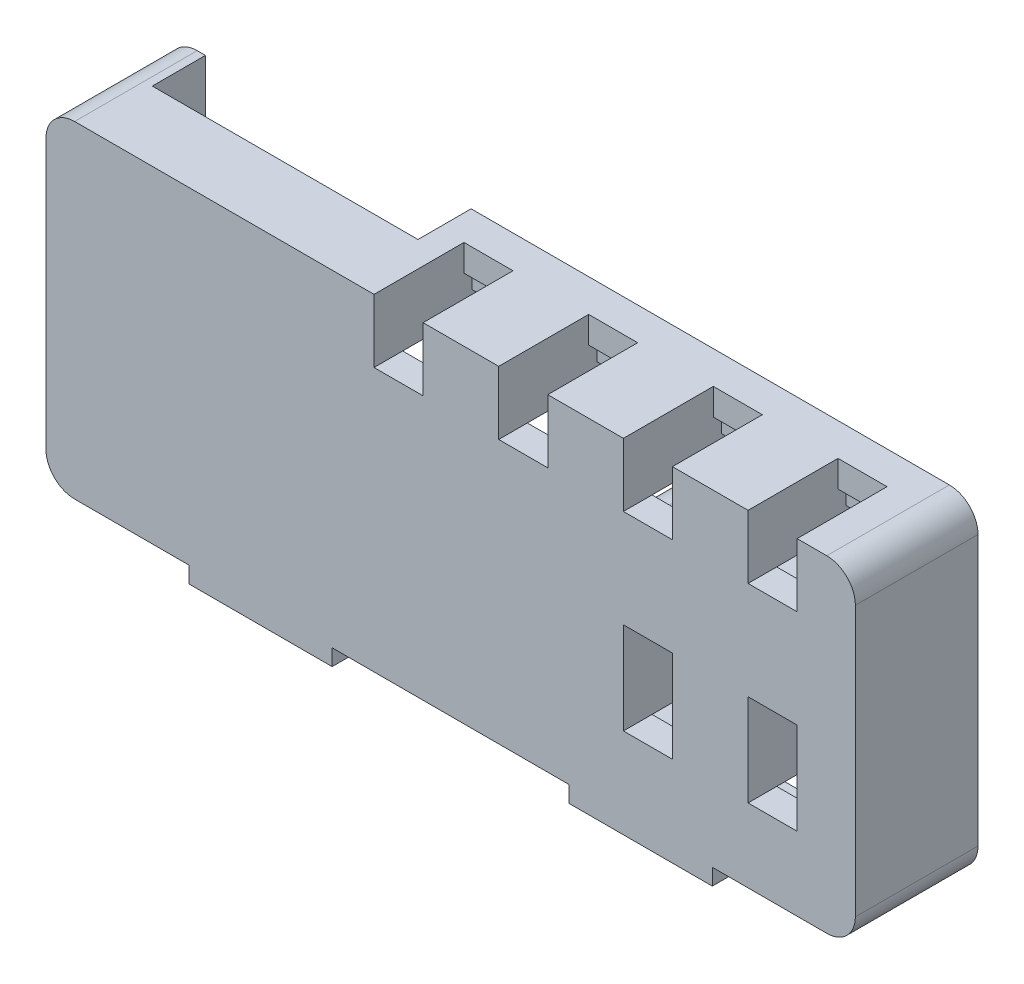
SolidWorks part; units mm, degrees
ref_plane "Front Plane" through (0, 0, 0) normal (0, 0, 1) x (1, 0, 0)
ref_plane "Top Plane" through (0, 0, 0) normal (0, 1, 0) x (1, 0, 0)
ref_plane "Right Plane" through (0, 0, 0) normal (1, 0, 0) x (0, 0, -1)
sketch "Sketch1" plane through (0, 0, 0) normal (0, 0, 1) x (1, 0, 0)
  line L1 (-39.7632, 2.206) -> (-0.1632, 2.206)
  line L2 (-39.7632, 2.206) -> (-39.7632, -13.794)
  line L3 (-39.7632, -13.794) -> (-0.1632, -13.794)
  line L4 (-0.1632, 2.206) -> (-0.1632, -13.794)
  line L5 (-38.1632, -0.894) -> (-1.7632, -0.894)
  line L6 (-38.1632, -0.894) -> (-38.1632, -11.994)
  line L7 (-38.1632, -11.994) -> (-1.7632, -11.994)
  line L8 (-1.7632, -0.894) -> (-1.7632, -11.994)
  dimension "D1" = 3.1
  dimension "D2" = 1.8
  dimension "D3" = 1.6
  dimension "D4" = 1.6
  dimension "D5" = 39.6
  dimension "D6" = 11.1
extrude "Boss-Extrude1" add sketch "Sketch1" along normal blind 4.6
sketch "Sketch2" plane through (0, 0, 0) normal (0, 0, 1) x (1, 0, 0)
  line L0 (-1.7632, -11.994) -> (-1.7632, -0.894) construction
  line L1 (-1.7632, -10.194) -> (-14.1632, -10.194)
  line L2 (-1.7632, -10.194) -> (-1.7632, -6.994)
  line L3 (-1.7632, -6.994) -> (-14.1632, -6.994)
  line L4 (-14.1632, -10.194) -> (-14.1632, -6.994)
  line L7 (-39.7632, -13.794) -> (-0.1632, -13.794) construction
  dimension "D1" = 3.2
  dimension "D2" = 3.6
  dimension "D3" = 12.4
extrude "Boss-Extrude2" add sketch "Sketch2" along normal up to surface (4.6 mm away)
sketch "Sketch3" plane through (0, 0, 0) normal (0, 0, 1) x (1, 0, 0)
  line L1 (-1.7632, -6.994) -> (-14.1632, -6.994)
  line L2 (-1.7632, -6.994) -> (-1.7632, -2.794)
  line L3 (-1.7632, -2.794) -> (-14.1632, -2.794)
  line L4 (-14.1632, -6.994) -> (-14.1632, -2.794)
  dimension "D2" = 4.2
extrude "Boss-Extrude3" add sketch "Sketch3" along normal up to surface (4.6 mm away)
sketch "Sketch4" plane through (0, 0, 0) normal (0, 0, 1) x (1, 0, 0)
  line L0 (-1.7632, -0.894) -> (-38.1632, -0.894) construction
  line L1 (-23.7132, -0.894) -> (-21.3132, -0.894)
  line L2 (-23.7132, -0.894) -> (-23.7132, 0.906)
  line L3 (-23.7132, 0.906) -> (-21.3132, 0.906)
  line L4 (-21.3132, -0.894) -> (-21.3132, 0.906)
  line L5 (-14.1632, -10.194) -> (-1.7632, -10.194) construction
  line L6 (-17.6132, -0.894) -> (-15.2132, -0.894)
  line L7 (-17.6132, -0.894) -> (-17.6132, 0.906)
  line L8 (-17.6132, 0.906) -> (-15.2132, 0.906)
  line L9 (-15.2132, -0.894) -> (-15.2132, 0.906)
  line L10 (-11.5132, -0.894) -> (-9.1132, -0.894)
  line L11 (-11.5132, -0.894) -> (-11.5132, 0.906)
  line L12 (-11.5132, 0.906) -> (-9.1132, 0.906)
  line L13 (-9.1132, -0.894) -> (-9.1132, 0.906)
  line L14 (-5.4132, -0.894) -> (-3.0132, -0.894)
  line L15 (-5.4132, -0.894) -> (-5.4132, 0.906)
  line L16 (-5.4132, 0.906) -> (-3.0132, 0.906)
  line L17 (-3.0132, -0.894) -> (-3.0132, 0.906)
  line L18 (-11.5132, -10.194) -> (-9.1132, -10.194)
  line L19 (-11.5132, -10.194) -> (-11.5132, -8.394)
  line L20 (-11.5132, -8.394) -> (-9.1132, -8.394)
  line L21 (-9.1132, -10.194) -> (-9.1132, -8.394)
  line L23 (-5.4132, -10.194) -> (-3.0132, -10.194)
  line L24 (-5.4132, -10.194) -> (-5.4132, -8.394)
  line L25 (-5.4132, -8.394) -> (-3.0132, -8.394)
  line L26 (-3.0132, -10.194) -> (-3.0132, -8.394)
  line L31 (-0.1632, -13.794) -> (-0.1632, 2.206) construction
  point P30 (-3.0132, -9.294)
  point P31 (-22.5132, 0.906)
  point P32 (-16.4132, 0.906)
  point P33 (-10.3132, 0.906)
  point P34 (-4.2132, 0.906)
  dimension "D1" = 2.4
  dimension "D2" = 2.4
  dimension "D3" = 6.1
  dimension "D4" = 6.1
  dimension "D5" = 2.4
  dimension "D6" = 2.4
  dimension "D7" = 6.1
  dimension "D8" = 1.8
  dimension "D9" = 2.85
  dimension "D10" = 1.8
  dimension "D11" = 2.4
  dimension "D12" = 3.7
  dimension "D13" = 2.4
  dimension "D14" = 2.85
extrude "Cut-Extrude1" cut sketch "Sketch4" along normal up to surface (4.6 mm away)
ref_plane "Plane1" through (0, -13.794, 0) normal (0, -1, 0) x (-1, 0, 0)
sketch "Sketch5" plane through (0, -13.794, 0) normal (0, -1, 0) x (-1, 0, 0)
  line L0 (39.7632, 0) -> (0.1632, 0) construction
  line L1 (9.9632, 0) -> (1.9632, 0)
  line L2 (9.9632, 0) -> (9.9632, -2.4)
  line L3 (9.9632, -2.4) -> (1.9632, -2.4)
  line L4 (1.9632, 0) -> (1.9632, -2.4)
  line L5 (39.7632, -4.6) -> (0.1632, -4.6) construction
  line L7 (0.1632, -4.6) -> (0.1632, 0) construction
  dimension "D1" = 8
  dimension "D2" = 2.2
  dimension "D3" = 1.8
extrude "Cut-Extrude2" cut sketch "Sketch5" against normal up to surface (1.8 mm away)
ref_plane "Plane2" through (0, 2.206, 0) normal (0, 1, 0) x (1, 0, 0)
sketch "Sketch6" plane through (0, 2.206, 0) normal (0, 1, 0) x (1, 0, 0)
  line L0 (-0.1632, 0) -> (-39.7632, 0) construction
  line L1 (-24.9632, 0) -> (-37.9632, 0)
  line L2 (-24.9632, 0) -> (-24.9632, -2.6)
  line L3 (-24.9632, -2.6) -> (-37.9632, -2.6)
  line L4 (-37.9632, 0) -> (-37.9632, -2.6)
  line L5 (-39.7632, -4.6) -> (-39.7632, 0) construction
  line L7 (-0.1632, -4.6) -> (-39.7632, -4.6) construction
  dimension "D1" = 1.8
  dimension "D2" = 2
  dimension "D3" = 13
extrude "Cut-Extrude3" cut sketch "Sketch6" against normal up to surface (3.1 mm away)
ref_plane "Plane3" through (0, 2.206, 0) normal (0, 1, 0) x (1, 0, 0)
sketch "Sketch7" plane through (0, 2.206, 0) normal (0, 1, 0) x (1, 0, 0)
  line L0 (-0.1632, -4.6) -> (-39.7632, -4.6) construction
  line L1 (-23.7132, -4.6) -> (-21.3132, -4.6)
  line L2 (-23.7132, -4.6) -> (-23.7132, -1.6)
  line L3 (-23.7132, -1.6) -> (-21.3132, -1.6)
  line L4 (-21.3132, -4.6) -> (-21.3132, -1.6)
  line L5 (-0.1632, -4.6) -> (-0.1632, 0) construction
  line L6 (-17.6132, -4.6) -> (-15.2132, -4.6)
  line L7 (-17.6132, -4.6) -> (-17.6132, -1.6)
  line L8 (-17.6132, -1.6) -> (-15.2132, -1.6)
  line L9 (-15.2132, -4.6) -> (-15.2132, -1.6)
  line L10 (-11.5132, -4.6) -> (-9.1132, -4.6)
  line L11 (-11.5132, -4.6) -> (-11.5132, -1.6)
  line L12 (-11.5132, -1.6) -> (-9.1132, -1.6)
  line L13 (-9.1132, -4.6) -> (-9.1132, -1.6)
  line L14 (-5.4132, -4.6) -> (-3.0132, -4.6)
  line L15 (-5.4132, -4.6) -> (-5.4132, -1.6)
  line L16 (-5.4132, -1.6) -> (-3.0132, -1.6)
  line L17 (-3.0132, -4.6) -> (-3.0132, -1.6)
  dimension "D1" = 2.4
  dimension "D2" = 2.4
  dimension "D3" = 2.4
  dimension "D4" = 2.4
  dimension "D5" = 3.7
  dimension "D6" = 3.7
  dimension "D7" = 3.7
  dimension "D8" = 3
  dimension "D9" = 3
  dimension "D10" = 3
  dimension "D11" = 3
  dimension "D12" = 2.85
extrude "Cut-Extrude4" cut sketch "Sketch7" against normal blind 3
sketch "Sketch8" plane through (0, 0, 0) normal (0, 0, 1) x (1, 0, 0)
  line L0 (-9.1132, -8.394) -> (-11.5132, -8.394) construction
  line L1 (-11.5132, -8.394) -> (-9.1132, -8.394)
  line L2 (-11.5132, -8.394) -> (-11.5132, -5.694)
  line L3 (-11.5132, -5.694) -> (-9.1132, -5.694)
  line L4 (-9.1132, -8.394) -> (-9.1132, -5.694)
  line L6 (-5.4132, -8.394) -> (-3.0132, -8.394)
  line L7 (-5.4132, -8.394) -> (-5.4132, -5.694)
  line L8 (-5.4132, -5.694) -> (-3.0132, -5.694)
  line L9 (-3.0132, -8.394) -> (-3.0132, -5.694)
  dimension "D1" = 2.7
  dimension "D2" = 2.7
extrude "Cut-Extrude5" cut sketch "Sketch8" along normal blind 5
fillet "Fillet2" radius 1.6 1 edges at (-14.1632, -2.794, 2.3)
sketch "Sketch10" plane through (0, 0, 0) normal (0, 0, 1) x (1, 0, 0)
  line L0 (-39.7632, -13.794) -> (-0.1632, -13.794) construction
  line L1 (-7.1632, -13.794) -> (-14.1632, -13.794)
  line L2 (-7.1632, -13.794) -> (-7.1632, -14.594)
  line L3 (-7.1632, -14.594) -> (-14.1632, -14.594)
  line L4 (-14.1632, -13.794) -> (-14.1632, -14.594)
  line L5 (-0.1632, -13.794) -> (-0.1632, 2.206) construction
  line L6 (-25.7632, -13.794) -> (-32.7632, -13.794)
  line L7 (-25.7632, -13.794) -> (-25.7632, -14.594)
  line L8 (-25.7632, -14.594) -> (-32.7632, -14.594)
  line L9 (-32.7632, -13.794) -> (-32.7632, -14.594)
  line L10 (-39.7632, 2.206) -> (-39.7632, -13.794) construction
  point P12 (-7.1632, -14.194)
  dimension "D1" = 0.8
  dimension "D2" = 0.8
  dimension "D3" = 7
  dimension "D4" = 7
  dimension "D5" = 7
  dimension "D6" = 7
extrude "Boss-Extrude5" add sketch "Sketch10" along normal up to surface (4.6 mm away)
sketch "Sketch11" plane through (0, 0, 0) normal (0, 0, 1) x (1, 0, 0)
  line L0 (-1.7632, -0.894) -> (-3.0132, -0.894) construction
  line L1 (-1.7632, -2.794) -> (-2.1632, -2.794)
  line L2 (-1.7632, -2.794) -> (-1.7632, -0.894)
  line L3 (-1.7632, -0.894) -> (-2.1632, -0.894)
  line L4 (-2.1632, -2.794) -> (-2.1632, -0.894)
  dimension "D1" = 0.4
extrude "Boss-Extrude6" add sketch "Sketch11" along normal up to surface (4.6 mm away)
sketch "Sketch12" plane through (0, 0, 0) normal (0, 0, 1) x (1, 0, 0)
  line L1 (-7.1632, -14.594) -> (-9.9632, -14.594)
  line L2 (-7.1632, -14.594) -> (-7.1632, -13.794)
  line L3 (-7.1632, -13.794) -> (-9.9632, -13.794)
  line L4 (-9.9632, -14.594) -> (-9.9632, -13.794)
extrude "Cut-Extrude6" cut sketch "Sketch12" along normal up to surface (2.4 mm away)
ref_plane "Plane4" through (0, 0, 4.6) normal (0, 0, 1) x (1, 0, 0)
sketch "Sketch14" plane through (0, 0, 4.6) normal (0, 0, 1) x (1, 0, 0)
  line L0 (-39.7632, -13.794) -> (-39.7632, 2.206)
  line L1 (-39.7632, 2.206) -> (-23.7132, 2.206)
  line L2 (-23.7132, 2.206) -> (-23.7132, -0.894)
  line L3 (-23.7132, -0.894) -> (-21.3132, -0.894)
  line L4 (-21.3132, -0.894) -> (-21.3132, 2.206)
  line L5 (-21.3132, 2.206) -> (-17.6132, 2.206)
  line L6 (-17.6132, 2.206) -> (-17.6132, -0.894)
  line L7 (-17.6132, -0.894) -> (-15.2132, -0.894)
  line L8 (-15.2132, -0.894) -> (-15.2132, 2.206)
  line L9 (-15.2132, 2.206) -> (-11.5132, 2.206)
  line L10 (-11.5132, 2.206) -> (-11.5132, -0.894)
  line L11 (-11.5132, -0.894) -> (-9.1132, -0.894)
  line L12 (-9.1132, -0.894) -> (-9.1132, 2.206)
  line L13 (-9.1132, 2.206) -> (-5.4132, 2.206)
  line L14 (-5.4132, 2.206) -> (-5.4132, -0.894)
  line L15 (-5.4132, -0.894) -> (-3.0132, -0.894)
  line L16 (-3.0132, -0.894) -> (-3.0132, 2.206)
  line L17 (-3.0132, 2.206) -> (-0.1632, 2.206)
  line L18 (-0.1632, 2.206) -> (-0.1632, -13.794)
  line L19 (-0.1632, -13.794) -> (-7.1632, -13.794)
  line L20 (-7.1632, -13.794) -> (-7.1632, -14.594)
  line L21 (-7.1632, -14.594) -> (-14.1632, -14.594)
  line L22 (-14.1632, -14.594) -> (-14.1632, -13.794)
  line L23 (-14.1632, -13.794) -> (-25.7632, -13.794)
  line L24 (-25.7632, -13.794) -> (-25.7632, -14.594)
  line L25 (-25.7632, -14.594) -> (-32.7632, -14.594)
  line L26 (-32.7632, -14.594) -> (-32.7632, -13.794)
  line L27 (-32.7632, -13.794) -> (-39.7632, -13.794)
  line L29 (-11.5132, -10.194) -> (-9.1132, -10.194)
  line L30 (-11.5132, -10.194) -> (-11.5132, -5.694)
  line L31 (-11.5132, -5.694) -> (-9.1132, -5.694)
  line L32 (-9.1132, -10.194) -> (-9.1132, -5.694)
  line L33 (-5.4132, -10.194) -> (-3.0132, -10.194)
  line L34 (-5.4132, -10.194) -> (-5.4132, -5.694)
  line L35 (-5.4132, -5.694) -> (-3.0132, -5.694)
  line L36 (-3.0132, -10.194) -> (-3.0132, -5.694)
extrude "Boss-Extrude7" add sketch "Sketch14" along normal blind 1.4
fillet "Fillet3" radius 1.4 4 edges at (-39.7632, 2.206, 3) (-0.1632, 2.206, 3) (-0.1632, -13.794, 3) (-39.7632, -13.794, 3)
sketch "Sketch15" plane through (0, 0, 0) normal (0, 0, 1) x (1, 0, 0)
  line L0 (-3.0132, 2.206) -> (-3.0132, -0.894) construction
  line L1 (-23.7132, 0.906) -> (-3.0132, 0.906)
  line L2 (-23.7132, 0.906) -> (-23.7132, 0.006)
  line L3 (-23.7132, 0.006) -> (-3.0132, 0.006)
  line L4 (-3.0132, 0.906) -> (-3.0132, 0.006)
  line L6 (-3.0132, -10.194) -> (-3.0132, -5.694) construction
  line L7 (-11.5132, -5.694) -> (-3.0132, -5.694)
  line L8 (-11.5132, -5.694) -> (-11.5132, -9.094)
  line L9 (-11.5132, -9.094) -> (-3.0132, -9.094)
  line L10 (-3.0132, -5.694) -> (-3.0132, -9.094)
  dimension "D1" = 0.9
  dimension "D2" = 3.4
extrude "Boss-Extrude8" add sketch "Sketch15" along normal blind 1.2
